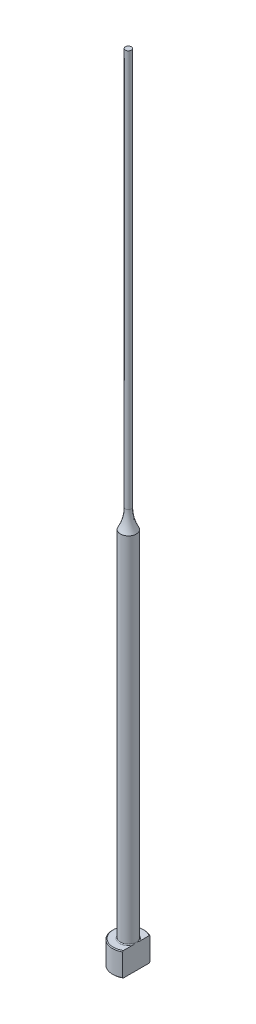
SolidWorks part; units mm, degrees
ref_plane "Front Plane" through (0, 0, 0) normal (0, 0, 1) x (1, 0, 0)
ref_plane "Top Plane" through (0, 0, 0) normal (0, 1, 0) x (1, 0, 0)
ref_plane "Right Plane" through (0, 0, 0) normal (1, 0, 0) x (0, 0, -1)
sketch "Sketch1" plane through (0, 0, 0) normal (0, 0, 1) x (1, 0, 0)
  line L0 (0, 259.9588) -> (0, -15.1925) construction
  line L1 (0, 0) -> (-4, 0)
  line L2 (-4, 0) -> (-4, 6)
  line L3 (-4, 6) -> (-2, 6)
  line L4 (-0.75, 100) -> (-0.75, 200)
  line L5 (-0.75, 200) -> (0, 200)
  line L6 (0, 200) -> (0, 0)
  line L7 (-2, 6) -> (-2, 95.1588)
  arc A0 (-2, 95.1588) -> (-0.75, 100) centre (-10.75, 100) ccw
  point P13 (-2, 0)
  dimension "D1" = 10
  dimension "L" = 200
  dimension "H" = 8
  dimension "T" = 6
  dimension "D" = 1.5
  dimension "B" = 4
  dimension "S" = 100
revolve "Revolve1" add sketch "Sketch1" angle 360 about L0
chamfer "Chamfer1" distance 0.2 angle 45 2 edges at (0, 6, 4) (0, 0, 4)
fillet "Fillet1" radius 0.2 1 edges at (0, 6, 2)
sketch "Sketch2" plane through (0, 0, 0) normal (0, 1, 0) x (1, 0, 0)
  line L0 (2, -3.4641) -> (2, 3.4641)
  circle A0 centre (0, 0) radius 4 construction
  arc A1 (2, -3.4641) -> (2, 3.4641) centre (0, 0) ccw
  circle A2 centre (0, 0) radius 2 construction
extrude "Keyed Head" cut sketch "Sketch2" along normal through all
